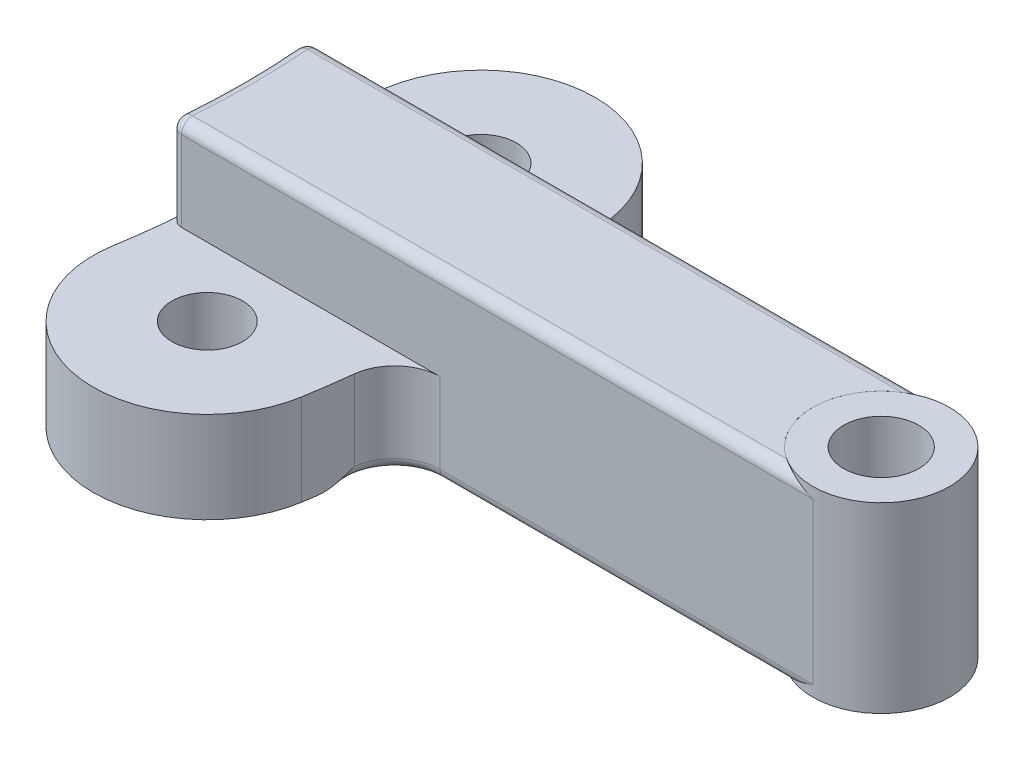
SolidWorks part; units mm, degrees
ref_plane "Front Plane" through (0, 0, 0) normal (0, 0, 1) x (1, 0, 0)
ref_plane "Top Plane" through (0, 0, 0) normal (0, 1, 0) x (1, 0, 0)
ref_plane "Right Plane" through (0, 0, 0) normal (1, 0, 0) x (0, 0, -1)
sketch "Sketch1" plane through (0, 0, 0) normal (0, 1, 0) x (1, 0, 0)
  line L0 (0, 0) -> (-41.8136, 0) construction
  line L1 (126.1512, -4.7625) -> (170.9012, -4.7625)
  line L3 (126.1512, 4.7625) -> (170.9012, 4.7625)
  arc A0 (126.1512, -4.7625) -> (126.1512, 4.7625) centre (75.575, 0) ccw
  circle A1 centre (170.9012, 0) radius 2.6162
  circle A2 centre (75.575, 0) radius 100.0887 construction
  arc A3 (170.9012, -4.7625) -> (170.9012, 4.7625) centre (170.9012, 0) ccw
  circle A5 centre (170.9012, 0) radius 4.7625 construction
  circle A6 centre (75.575, 0) radius 50.8 construction
  dimension "D2" = 5.2324
  dimension "D1" = 9.525
extrude "Boss-Extrude1" add sketch "Sketch1" along normal blind 12.7
sketch "Sketch2" plane through (0, 0, 0) normal (0, 1, 0) x (1, 0, 0)
  line L0 (216.2991, 0) -> (115.1404, 0) construction
  line L1 (126.1512, -4.7625) -> (170.9012, -4.7625) construction
  line L2 (170.9012, 4.7625) -> (126.1512, 4.7625) construction
  line L3 (125.5975, 18.8614) -> (125.5975, -17.3065) construction
  line L4 (175.6637, 15.7931) -> (175.6637, -12.1312) construction
  arc A0 (170.9012, -4.7625) -> (170.9012, 4.7625) centre (170.9012, 0) ccw construction
  circle A3 centre (133.535, -9.525) radius 1.7272 construction
  arc A4 (141.3675, -10.8122) -> (141.3675, 10.8122) centre (75.575, 0) ccw
  circle A6 centre (133.535, 9.525) radius 1.7272 construction
  arc A10 (141.3675, -10.8122) -> (125.7026, -8.2378) centre (133.535, -9.525) cw
  arc A12 (141.3675, 10.8122) -> (125.7026, 8.2378) centre (133.535, 9.525) ccw
  arc A13 (125.7026, -8.2378) -> (125.7026, 8.2378) centre (75.575, 0) ccw
  dimension "D1" = 50.8
  dimension "D2" = 66.675
  dimension "D3" = 50.0661
extrude "Boss-Extrude2" add sketch "Sketch2" along normal blind 6.35
hole_wizard "#10 (0.1935) Diameter Hole1" positions "Sketch4" profile "Sketch3" hole size "#10" standard "ANSI Inch"
sketch "Sketch4" plane through (0, 6.35, 0) normal (0, 1, 0) x (1, 0, 0)
  circle A0 centre (133.535, 9.525) radius 1.7272 construction
  circle A1 centre (133.535, -9.525) radius 1.7272 construction
  point P0 (133.535, -9.525)
  point P2 (133.535, 9.525)
sketch "Sketch3" plane through (133.535, 6.35, 9.525) normal (1, 0, 0) x (0, 0, 1)
  line L0 (0, 0) -> (0, 6.35)
  line L1 (0, 6.35) -> (2.4574, 6.35)
  line L2 (2.4574, 6.35) -> (2.4574, 0)
  line L5 (2.4574, 0) -> (0, 0)
  line L11 (0, -6.35) -> (0, 107.95) construction
  dimension "Thru Hole Dia." = 4.9149
  dimension "Thru Hole Depth" = 6.35
sketch "Sketch10" plane through (0, 12.7, 0) normal (0, 1, 0) x (1, 0, 0)
  circle A1 centre (170.9012, 0) radius 4.7625
  arc A2 (170.9012, -4.7625) -> (170.9012, 4.7625) centre (170.9012, 0) ccw construction
split "Split2" trim tools "Sketch10" bodies to split 103 resulting bodies 109 110
fillet "Fillet6" radius 3.175 2 edges at (142.0797, 3.175, -4.7625) (142.0797, 3.175, 4.7625)
fillet "Fillet7" radius 0.762 9 edges at (157.9369, 0, -4.7625) (142.8589, 0, -5.5683) (157.9369, 0, 4.7625) (142.8589, 0, 5.5683) (148.5262, 12.7, -4.7625) (148.5262, 12.7, 4.7625) (126.375, 12.7, 0) (126.1512, 9.525, -4.7625) (126.1512, 9.525, 4.7625)
